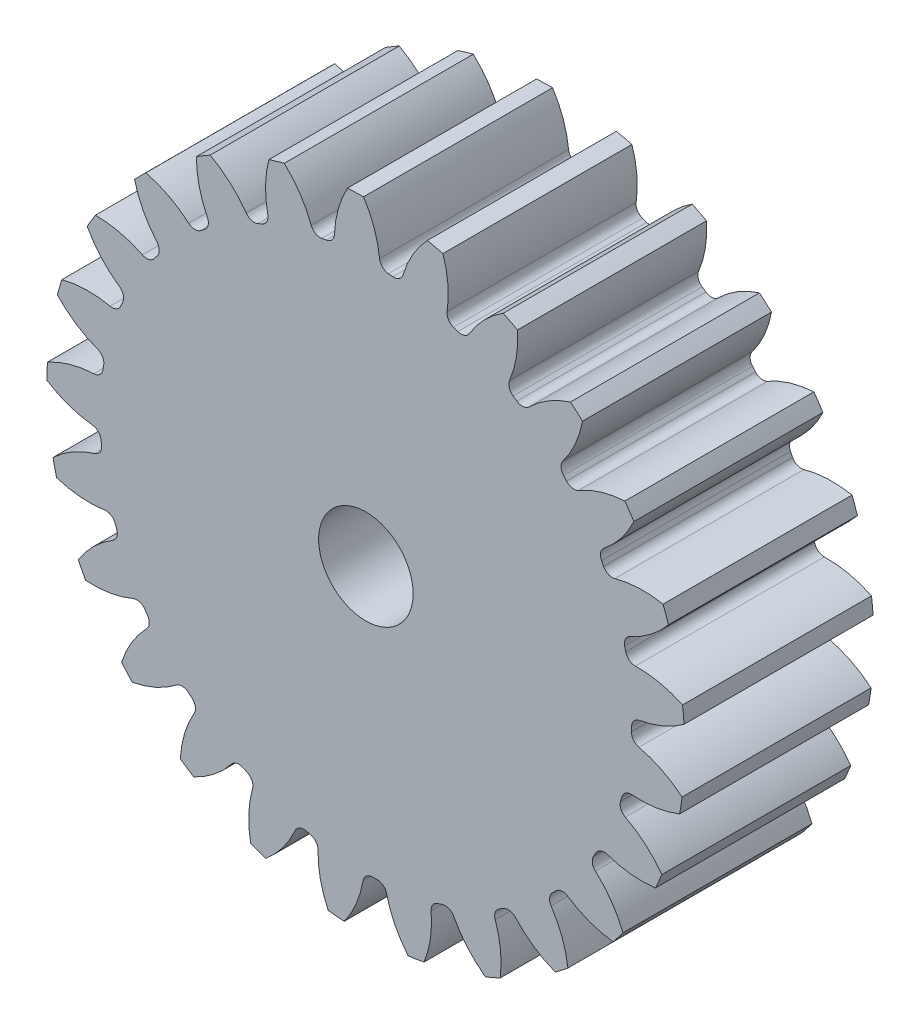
SolidWorks part; units mm, degrees
ref_plane "Front" through (0, 0, 0) normal (0, 0, 1) x (1, 0, 0)
ref_plane "Top" through (0, 0, 0) normal (0, 1, 0) x (1, 0, 0)
ref_plane "Right" through (0, 0, 0) normal (1, 0, 0) x (0, 0, -1)
sketch "Sketch3" plane through (0, 0, 0) normal (0, 0, 1) x (1, 0, 0)
  circle A0 centre (0, 0) radius 171.45
  dimension "od" = 342.9
extrude "gearBody" add sketch "Sketch3" along normal blind 101.6
sketch "Sketch2" plane through (0, 0, 0) normal (0, 0, 1) x (1, 0, 0)
  line L0 (0, 0) -> (137.8208, 57.0873) construction
  line L1 (170.387, -22.701) -> (0, 0) construction
  line L2 (0, 0) -> (36.3143, 0) construction
  line L3 (158.6672, 5.1278) -> (158.0643, -14.7394) construction
  line L5 (158.3657, -4.8058) -> (0, 0) construction
  line L7 (0, 0) -> (149.1762, 0) construction
  arc A0 (149.1591, 2.2621) -> (148.7474, -11.3024) centre (0, 0) ccw construction
  arc A1 (171.0286, 12.0139) -> (169.9854, -22.3624) centre (0, 0) ccw construction
  arc A2 (158.6672, 5.1278) -> (158.0643, -14.7394) centre (0, 0) ccw construction
  arc A3 (142.7665, -5.567) -> (142.8414, -3.1002) centre (0, 0) ccw
  arc A4 (170.387, -22.701) -> (146.7629, -10.8034) centre (134.1057, -65.3392) ccw
  arc A5 (170.387, -22.701) -> (171.45, 12.3275) centre (0, 0) ccw
  arc A6 (171.45, 12.3275) -> (147.1479, 1.8843) centre (137.8208, 57.0873) cw
  arc A7 (142.8414, -3.1002) -> (147.1479, 1.8843) centre (148.009, -3.2123) cw
  arc A8 (146.7629, -10.8034) -> (142.7665, -5.567) centre (147.9315, -5.7684) cw
  point P6 (171.45, 12.3275)
  point P22 (170.387, -22.701)
  dimension "baseDia" = 298.3524
  dimension "od" = 342.9
  dimension "pd" = 317.5
  dimension "rd" = 285.75
  dimension "rFillet" = 5.1689
  dimension "pointX" = 171.45
  dimension "pointY" = 12.3275
  dimension "CTT" = 19.8672
  dimension "flankCenterAngle" = 22.5
extrude "toothCut" cut sketch "Sketch2" along normal through all
pattern_circular "CirPattern1" count 25 over 360 about axis through (0, 0, 0) along (0, 0, 1) of "toothCut"
sketch "hub1Dia" plane through (0, 0, 0) normal (0, 0, -1) x (-1, 0, 0)
  circle A0 centre (0, 0) radius 12.7
  dimension "hub1Dia" = 25.4
sketch "hub2Dia" plane through (0, 0, 101.6) normal (0, 0, 1) x (1, 0, 0)
  circle A0 centre (0, 0) radius 12.7
  dimension "hub2dia" = 25.4
sketch "boreDia" plane through (0, 0, 0) normal (0, 0, 1) x (1, 0, 0)
  circle A0 centre (0, 0) radius 25.4
  dimension "boreDia" = 50.8
extrude "bore" cut sketch "boreDia" against normal mid plane 25400
